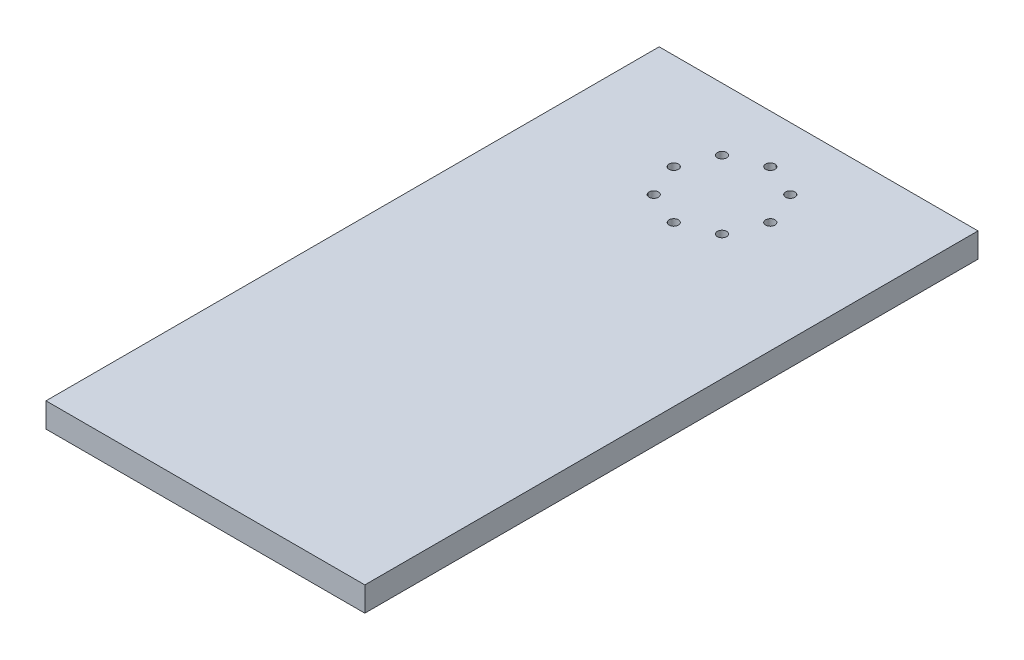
SolidWorks part; units mm, degrees
ref_plane "Front Plane" through (0, 0, 0) normal (0, 0, 1) x (1, 0, 0)
ref_plane "Top Plane" through (0, 0, 0) normal (0, 1, 0) x (1, 0, 0)
ref_plane "Right Plane" through (0, 0, 0) normal (1, 0, 0) x (0, 0, -1)
sketch "Sketch1" plane through (0, 0, 0) normal (0, 1, 0) x (1, 0, 0)
  line L1 (-82.55, -267.5) -> (82.55, -267.5)
  line L2 (-82.55, -267.5) -> (-82.55, 50)
  line L3 (-82.55, 50) -> (82.55, 50)
  line L4 (82.55, -267.5) -> (82.55, 50)
  dimension "D1" = 165.1
  dimension "D2" = 317.5
  dimension "D3" = 82.55
  dimension "D4" = 50
extrude "Base_extrude" add sketch "Sketch1" against normal blind 12.7
sketch "Sketch13" plane through (0, 0, 0) normal (0, 1, 0) x (1, 0, 0)
  line L0 (-6.985, 0) -> (6.985, 0) construction
  line L1 (0, 0) -> (-17.6777, -17.6777) construction
  line L5 (0, -6.985) -> (0, 6.985) construction
  circle A0 centre (0, 0) radius 25 construction
  circle A1 centre (-17.6777, -17.6777) radius 2.415
  dimension "D2" = 50
  dimension "D4" = 4.83
  dimension "D1" = 45
extrude "Cut-Extrude4" cut sketch "Sketch13" against normal through all
pattern_circular "CirPattern1" count 8 over 360 about axis through (0, 0, 0) along (0, 1, 0) of "Cut-Extrude4"
